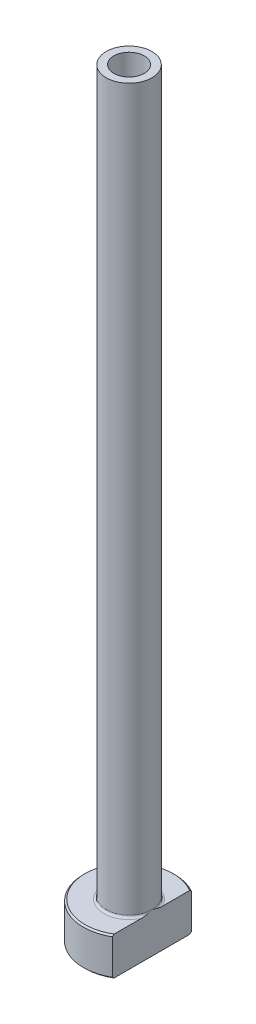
SolidWorks part; units mm, degrees
ref_plane "Front Plane" through (0, 0, 0) normal (0, 0, 1) x (1, 0, 0)
ref_plane "Top Plane" through (0, 0, 0) normal (0, 1, 0) x (1, 0, 0)
ref_plane "Right Plane" through (0, 0, 0) normal (1, 0, 0) x (0, 0, -1)
sketch "Sketch1" plane through (0, 0, 0) normal (0, 0, 1) x (1, 0, 0)
  line L0 (-2, 100) -> (-3, 100)
  line L1 (-3, 100) -> (-3, 5)
  line L2 (-3, 5) -> (-6, 5)
  line L3 (-6, 5) -> (-6, 0)
  line L4 (5.5, 0) -> (-5.5, 0) construction
  line L5 (-6, 0) -> (-2.25, 0)
  line L6 (-2, 55) -> (-2, 100)
  line L7 (0, 92.1877) -> (0, -15.5353) construction
  line L8 (0, -6.6) -> (0, 6.6) construction
  line L9 (-2, 55) -> (-2.25, 43)
  line L10 (-2.25, 43) -> (-2.25, 0)
  dimension "D1" = 0.25
  dimension "ID" = 4
  dimension "OD" = 6
  dimension "L" = 100
  dimension "H" = 12
  dimension "T" = 5
  dimension "N" = 45
  dimension "D2" = 12
  dimension "L-N" = 55
revolve "Revolve1" add sketch "Sketch1" angle 360 about L7
fillet "Fillet1" radius 0.3 1 edges at (0, 5, 3)
chamfer "Chamfer1" distance 0.2 angle 45 2 edges at (0, 5, 6) (0, 0, 6)
sketch "Sketch2" plane through (0, 0, 0) normal (0, -1, 0) x (1, 0, 0)
  line L0 (3, 5.1962) -> (3, -5.1962)
  circle A0 centre (0, 0) radius 6 construction
  arc A1 (3, 5.1962) -> (3, -5.1962) centre (0, 0) cw
  circle A2 centre (0, 0) radius 3 construction
extrude "Cut-Extrude1" cut sketch "Sketch2" against normal through all
chamfer "Chamfer2" distance 0.5 angle 45 1 edges at (0, 0, 2.25)
